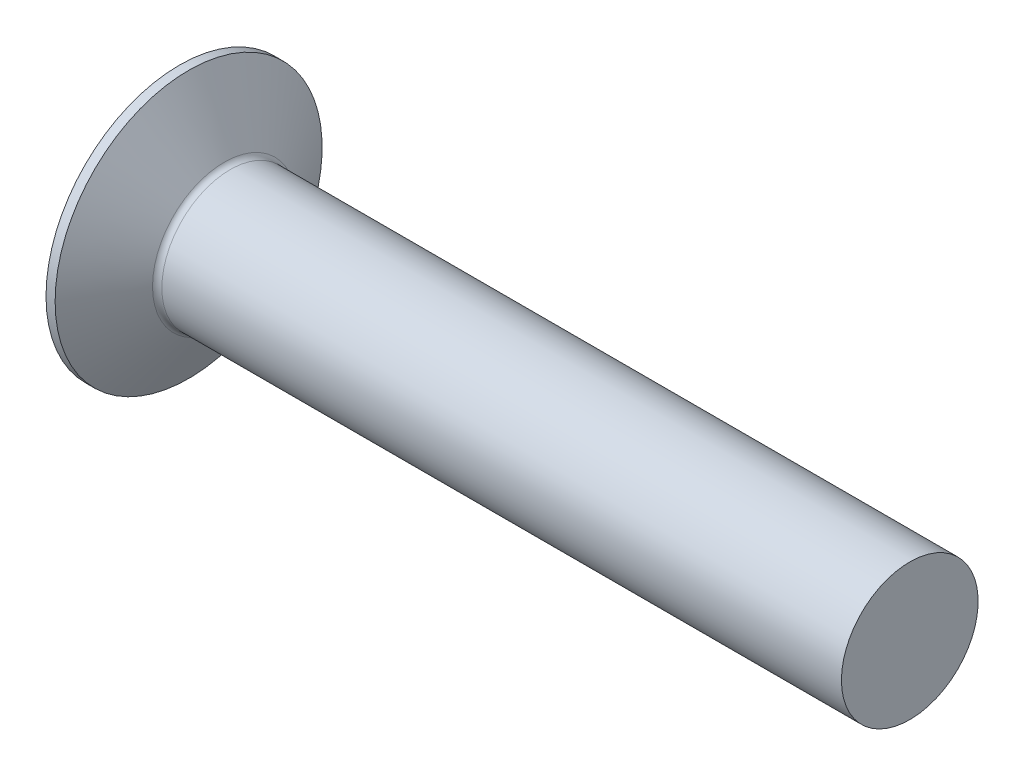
SolidWorks part; units mm, degrees
ref_plane "Front" through (0, 0, 0) normal (0, 0, 1) x (1, 0, 0)
ref_plane "Top" through (0, 0, 0) normal (0, 1, 0) x (1, 0, 0)
ref_plane "Right" through (0, 0, 0) normal (1, 0, 0) x (0, 0, -1)
other "Configuration Table"
sketch "Sketch1" plane through (0, 0, 0) normal (0, 0, 1) x (1, 0, 0)
  line L0 (-58.1433, 0) -> (17.5601, 0) construction
  line L1 (32.9775, 0) -> (32.9775, 3)
  line L2 (32.9775, 3) -> (3.1507, 3)
  line L3 (2.8909, 3.15) -> (1.3263, 5.86)
  line L4 (1.3263, 5.86) -> (0.9263, 5.86)
  line L5 (32.9775, 0) -> (0, 0)
  arc A0 (0.9263, 5.86) -> (0, 0) centre (19, 0) ccw
  arc A1 (3.1507, 3) -> (2.8909, 3.15) centre (3.1507, 3.3) cw
  point P12 (2.9775, 3)
  dimension "r" = 19
  dimension "r1" = 0.3
  dimension "d" = 6
  dimension "l" = 30
  dimension "D2" = 60
  dimension "K" = 0.4
  dimension "dk" = 11.72
revolve "Base-Revolve" add sketch "Sketch1" angle 360 about L0
